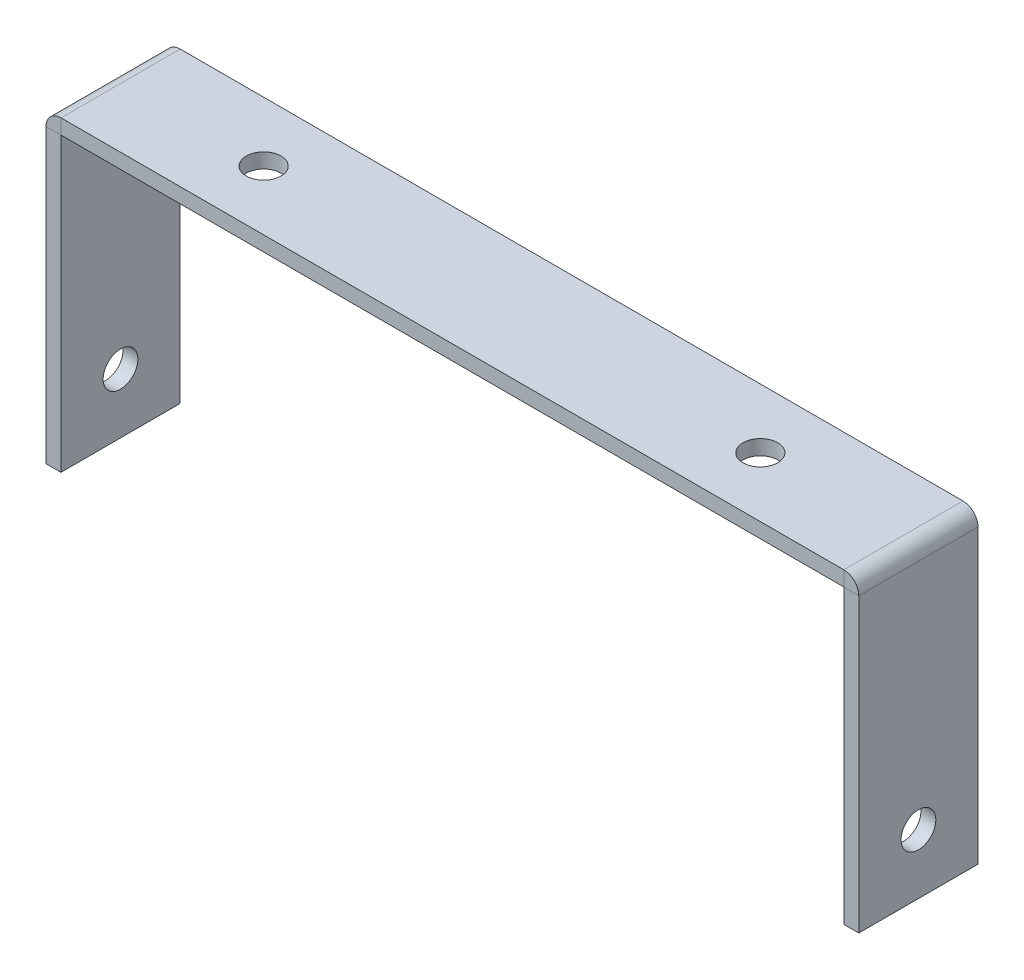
SolidWorks part; units mm, degrees
ref_plane "Front Plane" through (0, 0, 0) normal (0, 0, 1) x (1, 0, 0)
ref_plane "Top Plane" through (0, 0, 0) normal (0, 1, 0) x (1, 0, 0)
ref_plane "Right Plane" through (0, 0, 0) normal (1, 0, 0) x (0, 0, -1)
sketch "Sketch1" plane through (0, 0, 0) normal (0, 1, 0) x (1, 0, 0)
  line L0 (0, 6) -> (70, 6) construction
  line L1 (-70, 0) -> (70, 0)
  line L2 (0, 0) -> (0, 12) construction
  line L3 (-70, 12) -> (70, 12)
  line L4 (70, 0) -> (70, 12)
  line L5 (-70, 0) -> (-70, 12)
  circle A0 centre (25, 6) radius 1.75
  circle A1 centre (64, 6) radius 1.75
  circle A2 centre (-64, 6) radius 1.75
  circle A3 centre (-25, 6) radius 1.75
  dimension "D1" = 6
  dimension "D2" = 12
  dimension "D3" = 25
  dimension "D4" = 70
sheet metal parameters "Sheet-Metal1" thickness 1.5 parameters "D1"=0.01
base flange "Base-Flange1" sketch "Sketch1" thickness 1.5 reverse thickness direction yes parameters "D1"=0.01
sketch "Sketch4" plane through (0, 1.5, 0) normal (0, 1, 0) x (-1, 0, 0)
  line L0 (0, 0) -> (0, -12) construction
  line L1 (70, 0) -> (-70, 0) construction
  line L2 (-70, -12) -> (70, -12) construction
  line L3 (-40, 0) -> (-40, -12)
  line L4 (40, 0) -> (40, -12)
sketched bend "Sketched Bend1" parameters "D1"=0
bend "SketchBend1" bend radius 0.01 bend angle 90 parameters "D5"=1
bend "SketchBend2" bend radius 0 bend angle 90 parameters "D5"=2
flat pattern "Flat-Pattern1"
sketch "Bend-Lines1" plane through (0, 0, 0) normal (0, 1, 0) x (-1, 0, 0)
bend of the flat pattern "Flatten-<SketchBend1>1"
bend of the flat pattern "Flatten-<SketchBend2>1"
